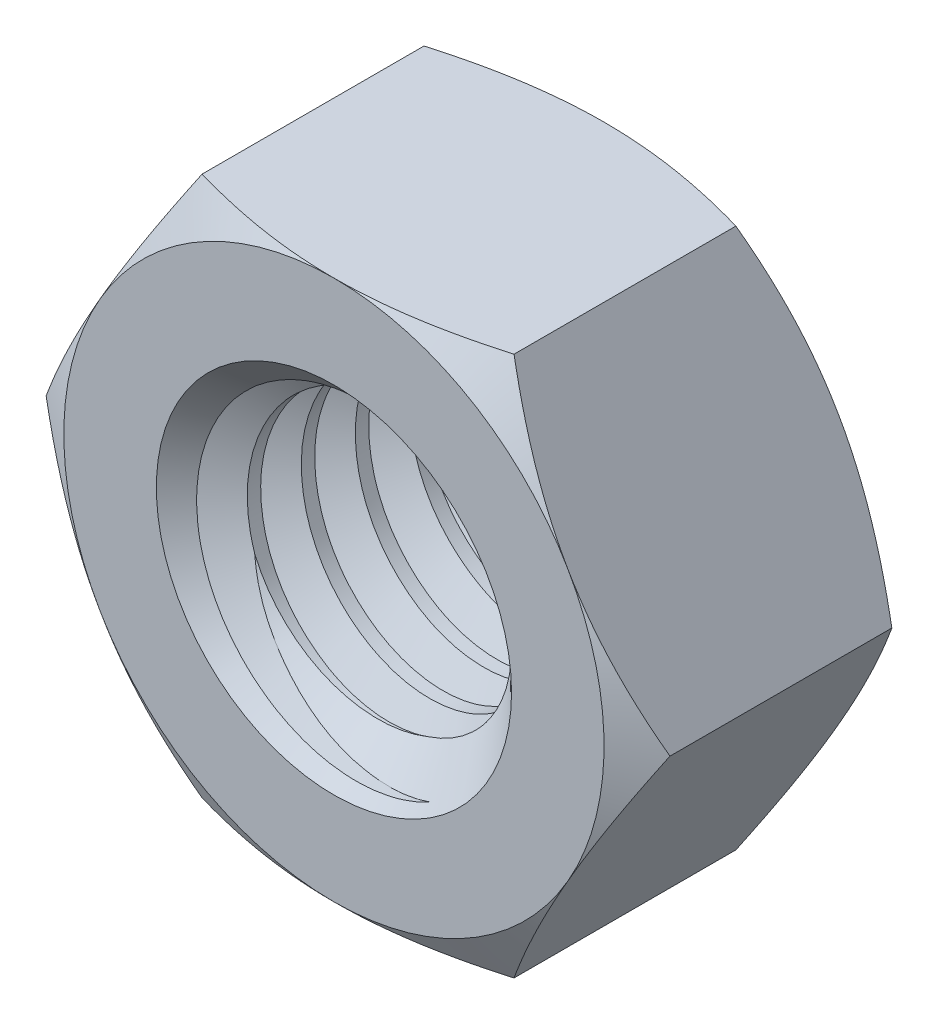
SolidWorks part; units mm, degrees
ref_plane "Front" through (0, 0, 0) normal (0, 0, 1) x (1, 0, 0)
ref_plane "Top" through (0, 0, 0) normal (0, 1, 0) x (1, 0, 0)
ref_plane "Right" through (0, 0, 0) normal (1, 0, 0) x (0, 0, -1)
sketch "Çizim1" plane through (0, 0, 0) normal (0, 0, 1) x (1, 0, 0)
  line L1 (4.6188, 0) -> (2.3094, 4)
  line L2 (2.3094, 4) -> (-2.3094, 4)
  line L3 (-2.3094, 4) -> (-4.6188, 0)
  line L4 (-4.6188, 0) -> (-2.3094, -4)
  line L5 (-2.3094, -4) -> (2.3094, -4)
  line L6 (2.3094, -4) -> (4.6188, 0)
  circle A0 centre (0, 0) radius 4 construction
  point P1 (0, 0)
  dimension "D1" = 8
extrude "Yükseklik-Ekstrüzyon1" add sketch "Çizim1" along normal blind 4
sketch "Çizim2" plane through (0, 0, 4) normal (0, 0, 1) x (1, 0, 0)
  circle A0 centre (0, 0) radius 4
extrude "Kes-Ekstrüzyon1" cut sketch "Çizim2" against normal blind 4 draft 60 flip side to cut
sketch "Çizim3" plane through (0, 0, 0) normal (0, 0, -1) x (-1, 0, 0)
  circle A0 centre (0, 0) radius 4
extrude "Kes-Ekstrüzyon2" cut sketch "Çizim3" against normal blind 4 draft 60 flip side to cut
sketch "Çizim4" plane through (0, 0, 4) normal (0, 0, 1) x (1, 0, 0)
  circle A0 centre (0, 0) radius 1.98
  dimension "D1" = 3.96
extrude "Kes-Ekstrüzyon3" cut sketch "Çizim4" against normal blind 4
chamfer "Pah1" distance 0.65 angle 45 2 edges at (1.98, 0, 0) (1.98, 0, 4)
sketch "Çizim5" plane through (0, 0, 0) normal (0, 0, -1) x (-1, 0, 0)
  circle A0 centre (0, 0) radius 1.98
curve "Helis/Spiral1"
ref_plane "Düzlem1" through (0, 1.98, 5) normal (-0.9979, 0, 0.0642) x (0.0642, 0, 0.9979)
sketch "Çizim6" plane through (0, 1.98, 5) normal (-0.9979, 0, 0.0642) x (0.0642, 0, 0.9979)
  line L1 (0, 0.52) -> (-0.3833, -0.1439)
  line L3 (0.3833, -0.1439) -> (0, 0.52)
  line L4 (0.3833, -0.1439) -> (-0.3833, -0.1439)
  line L5 (0, -0.26) -> (0.4503, -0.26)
  circle A0 centre (0, 0) radius 0.26 construction
  dimension "D1" = 0.52
sweep "Kes-Süpür1" cut profiles "Çizim6" path "Helis/Spiral1"
